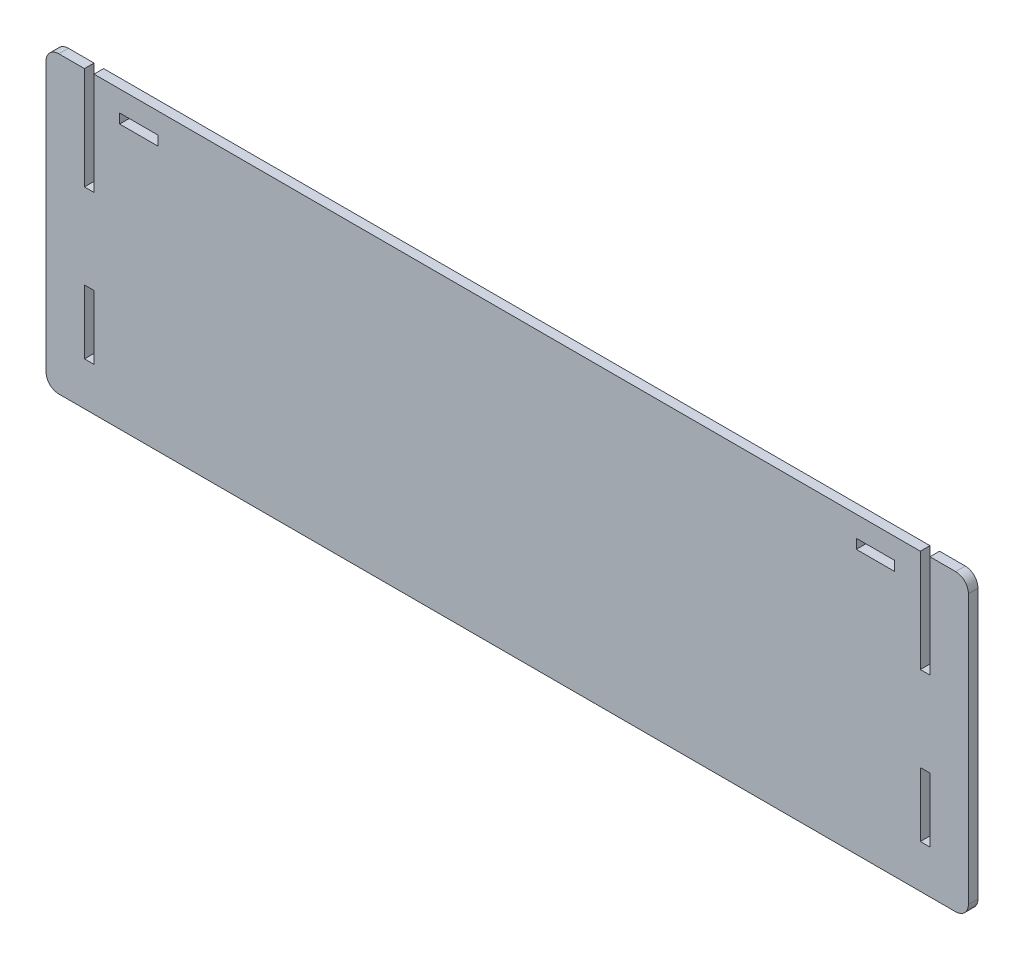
SolidWorks part; units mm, degrees
ref_plane "Front Plane" through (0, 0, 0) normal (0, 0, 1) x (1, 0, 0)
ref_plane "Top Plane" through (0, 0, 0) normal (0, 1, 0) x (1, 0, 0)
ref_plane "Right Plane" through (0, 0, 0) normal (1, 0, 0) x (0, 0, -1)
sketch "Sketch2" plane through (0, 0, 0) normal (0, 0, 1) x (1, 0, 0)
  line L1 (-914.4, 292.1) -> (914.4, 292.1)
  line L2 (-914.4, 292.1) -> (-914.4, -292.1)
  line L3 (-914.4, -292.1) -> (914.4, -292.1)
  line L4 (914.4, 292.1) -> (914.4, -292.1)
  line L5 (-914.4, 292.1) -> (914.4, -292.1) construction
  line L6 (-914.4, -292.1) -> (914.4, 292.1) construction
  point P0 (0, 0)
  dimension "D1" = 1828.8
  dimension "D2" = 584.2
extrude "Boss-Extrude1" add sketch "Sketch2" along normal blind 19.05
sketch "Sketch3" plane through (0, 0, 0) normal (0, 0, -1) x (-1, 0, 0)
  line L0 (-914.4, 292.1) -> (914.4, 292.1) construction
  line L1 (-914.4, -292.1) -> (-914.4, 292.1) construction
  line L3 (-838.2, 292.1) -> (-819.15, 292.1)
  line L4 (-838.2, 292.1) -> (-838.2, 88.9)
  line L5 (-838.2, 88.9) -> (-819.15, 88.9)
  line L6 (-819.15, 292.1) -> (-819.15, 88.9)
  dimension "D1" = 203.2
  dimension "D2" = 19.05
  dimension "D4" = 76.2
extrude "Cut-Extrude1" cut sketch "Sketch3" against normal through all
fillet "Fillet1" radius 25.4 4 edges at (-914.4, 292.1, 9.525) (-914.4, -292.1, 9.525) (914.4, -292.1, 9.525) (914.4, 292.1, 9.525)
mirror "Mirror3" about plane through (0, 0, 0) normal (1, 0, 0) of "Cut-Extrude1"
sketch "Sketch6" plane through (0, 0, 0) normal (0, 0, -1) x (-1, 0, 0)
  line L0 (-838.2, 292.1) -> (-838.2, 88.9) construction
  line L1 (-838.2, -79.375) -> (-819.15, -79.375)
  line L2 (-838.2, -79.375) -> (-838.2, -206.375)
  line L3 (-838.2, -206.375) -> (-819.15, -206.375)
  line L4 (-819.15, -79.375) -> (-819.15, -206.375)
  line L5 (-819.15, 88.9) -> (-819.15, 292.1) construction
  line L6 (889, -292.1) -> (-889, -292.1) construction
  dimension "D1" = 85.725
  dimension "D2" = 127
extrude "Cut-Extrude4" cut sketch "Sketch6" against normal through all
mirror "Mirror4" about plane through (0, 0, 0) normal (1, 0, 0) of "Cut-Extrude4"
sketch "Sketch7" plane through (0, 0, 0) normal (0, 0, -1) x (-1, 0, 0)
  line L0 (-819.15, 88.9) -> (-819.15, 292.1) construction
  line L1 (-768.35, 250.825) -> (-692.15, 250.825)
  line L2 (-768.35, 250.825) -> (-768.35, 231.775)
  line L3 (-768.35, 231.775) -> (-692.15, 231.775)
  line L4 (-692.15, 250.825) -> (-692.15, 231.775)
  line L5 (-819.15, 292.1) -> (819.15, 292.1) construction
  dimension "D1" = 50.8
  dimension "D2" = 19.05
  dimension "D3" = 76.2
  dimension "D4" = 41.275
extrude "Cut-Extrude5" cut sketch "Sketch7" against normal through all
mirror "Mirror5" about plane through (0, 0, 0) normal (1, 0, 0) of "Cut-Extrude5"
equation "\"0.750.74in\"=0.1"
